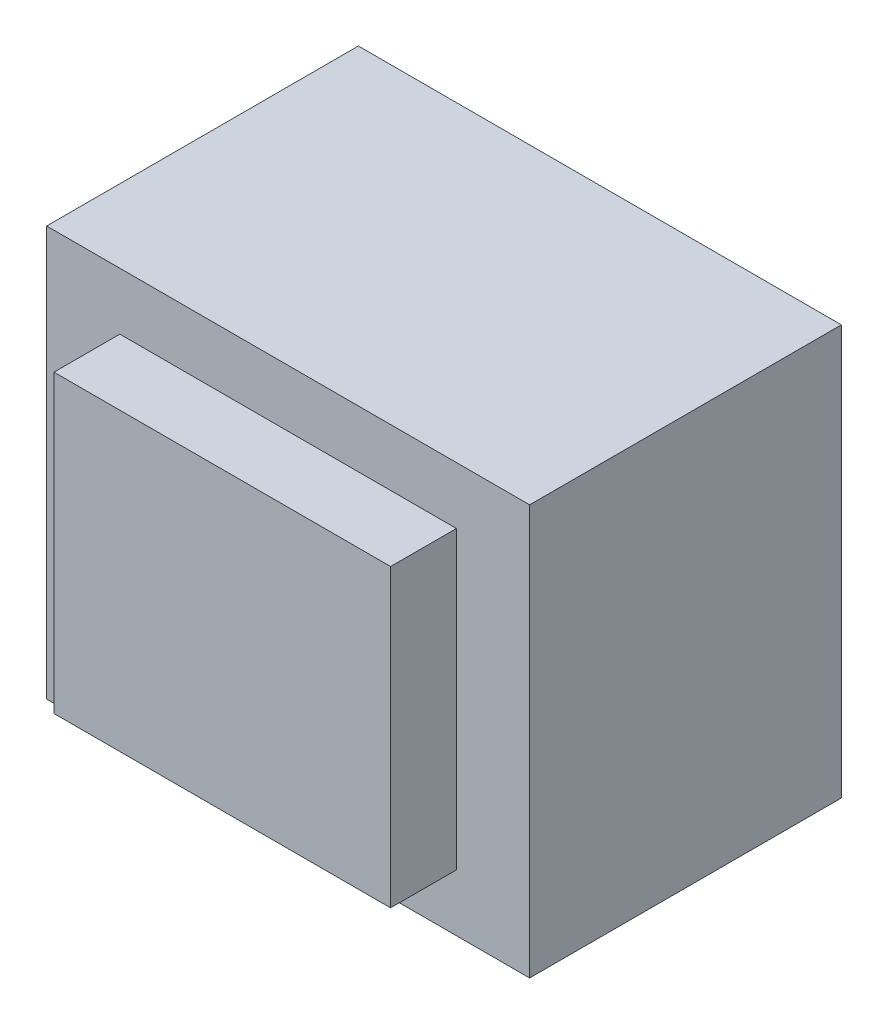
SolidWorks part; units mm, degrees
ref_plane "Front Plane" through (0, 0, 0) normal (0, 0, 1) x (1, 0, 0)
ref_plane "Top Plane" through (0, 0, 0) normal (0, 1, 0) x (1, 0, 0)
ref_plane "Right Plane" through (0, 0, 0) normal (1, 0, 0) x (0, 0, -1)
sketch "Sketch1" plane through (0, 0, 0) normal (0, 0, 1) x (1, 0, 0)
  line L1 (-16.5, 14) -> (16.5, 14)
  line L2 (-16.5, 14) -> (-16.5, -14)
  line L3 (-16.5, -14) -> (16.5, -14)
  line L4 (16.5, 14) -> (16.5, -14)
extrude "Boss-Extrude1" add sketch "Sketch1" along normal blind 21.3
sketch "Sketch2" plane through (0, 0, 21.3) normal (0, 0, 1) x (1, 0, 0)
  line L1 (-11.5, 10.1) -> (11.5, 10.1)
  line L2 (-11.5, 10.1) -> (-11.5, -10.1)
  line L3 (-11.5, -10.1) -> (11.5, -10.1)
  line L4 (11.5, 10.1) -> (11.5, -10.1)
extrude "Boss-Extrude2" add sketch "Sketch2" along normal blind 4.5
sketch "Sketch3" plane through (0, 0, 0) normal (0, 0, -1) x (-1, 0, 0)
  circle A0 centre (-10, 10) radius 1
  circle A1 centre (-5, 10) radius 1
  circle A2 centre (0, 10) radius 1
  circle A3 centre (5, 10) radius 1
  circle A4 centre (10, 10) radius 1
  circle A5 centre (-10, -10) radius 1
  circle A6 centre (-5, -10) radius 1
  circle A7 centre (0, -10) radius 1
  circle A8 centre (5, -10) radius 1
  circle A9 centre (10, -10.2757) radius 1
extrude "Boss-Extrude3" add sketch "Sketch3" along normal blind 2.54 separate body
